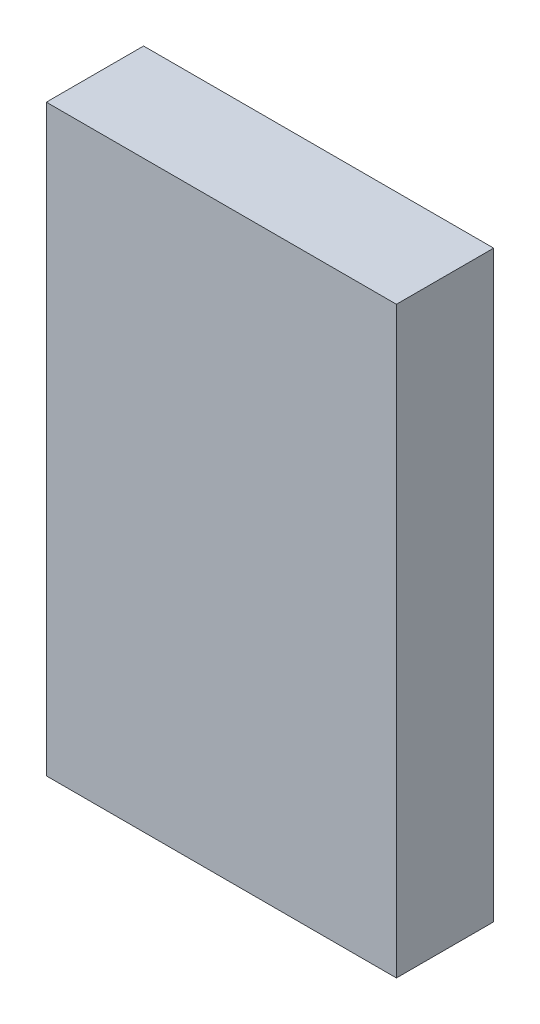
SolidWorks part; units mm, degrees
ref_plane "Plan de face" through (0, 0, 0) normal (0, 0, 1) x (1, 0, 0)
ref_plane "Plan de dessus" through (0, 0, 0) normal (0, 1, 0) x (1, 0, 0)
ref_plane "Plan de droite" through (0, 0, 0) normal (1, 0, 0) x (0, 0, -1)
sketch "Esquisse1" plane through (0, 0, 0) normal (0, 0, 1) x (1, 0, 0)
  line L1 (0, 0) -> (90, 0)
  line L2 (0, 0) -> (0, 150)
  line L3 (0, 150) -> (90, 150)
  line L4 (90, 0) -> (90, 150)
  dimension "D1" = 150
  dimension "D2" = 90
extrude "Boss.-Extru.1" add sketch "Esquisse1" along normal blind 25
